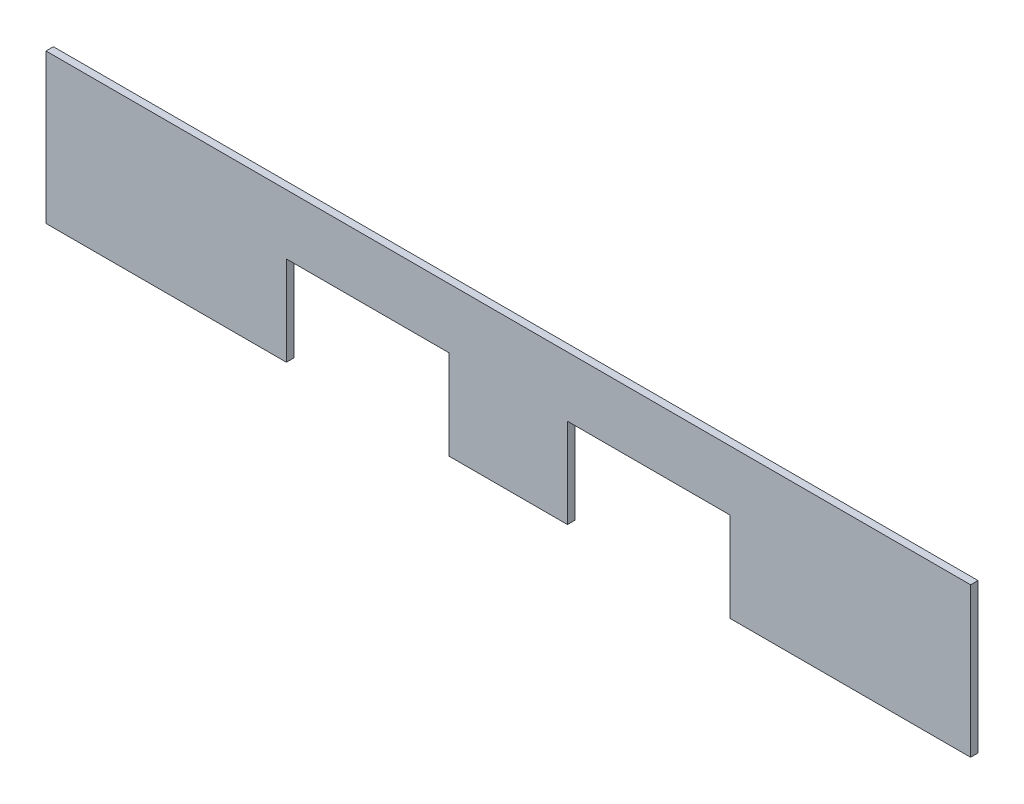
SolidWorks part; units mm, degrees
ref_plane "Front Plane" through (0, 0, 0) normal (0, 0, 1) x (1, 0, 0)
ref_plane "Top Plane" through (0, 0, 0) normal (0, 1, 0) x (1, 0, 0)
ref_plane "Right Plane" through (0, 0, 0) normal (1, 0, 0) x (0, 0, -1)
body saved out of another part "Basisteil-Bodenplatte Berechnung-1"
sketch "Sketch1" plane through (0, 0, 0) normal (0, 0, 1) x (1, 0, 0)
  line L3 (80, 120) -> (80, 0)
  line L4 (80, 0) -> (300, 0)
  line L5 (300, 0) -> (300, 120)
  line L6 (90, 110) -> (90, 10)
  line L7 (290, 110) -> (90, 110)
  line L8 (290, 10) -> (290, 110)
  line L9 (90, 10) -> (290, 10)
  line L10 (90, 110) -> (90, 10) construction
  line L11 (290, 110) -> (90, 110) construction
  line L12 (290, 10) -> (290, 110) construction
  line L13 (90, 10) -> (290, 10) construction
  line L14 (300, 120) -> (80, 120)
  line L15 (-90, 10) -> (-90, 110)
  line L16 (-290, 10) -> (-90, 10)
  line L17 (-290, 110) -> (-290, 10)
  line L18 (-90, 110) -> (-290, 110)
  line L19 (-90, 10) -> (-90, 110) construction
  line L20 (-290, 10) -> (-90, 10) construction
  line L21 (-290, 110) -> (-290, 10) construction
  line L22 (-90, 110) -> (-290, 110) construction
  line L23 (-80, 0) -> (-80, 120)
  line L24 (-80, 120) -> (-300, 120)
  line L25 (-300, 120) -> (-300, 0)
  line L26 (-300, 0) -> (-80, 0)
  dimension "D1" = 0
  dimension "D2" = 0
  dimension "D3" = 10
  dimension "D4" = 10
extrude "Extrude3" cut sketch "Sketch1" along normal through all
sketch "Sketch2" plane through (0, 200, 0) normal (0, 1, 0) x (1, 0, 0)
  line L4 (625, -190) -> (-625, -190)
  line L5 (-625, -190) -> (-625, -200)
  line L6 (-625, -200) -> (625, -200)
  line L7 (625, -200) -> (625, -190)
  line L8 (625, -190) -> (-625, -190)
  line L9 (-625, -190) -> (-625, -200)
  line L10 (-625, -200) -> (625, -200)
  line L11 (625, -200) -> (625, -190)
  dimension "D1" = 0
extrude "Extrude4" add sketch "Sketch2" along normal blind 1
sketch "Sketch3" plane through (0, 0, 0) normal (0, -1, 0) x (1, 0, 0)
  line L4 (300, 200) -> (300, 190)
  line L5 (300, 190) -> (625, 190)
  line L6 (625, 190) -> (625, 200)
  line L7 (625, 200) -> (300, 200)
  line L8 (300, 200) -> (300, 190)
  line L9 (300, 190) -> (625, 190)
  line L10 (625, 190) -> (625, 200)
  line L11 (625, 200) -> (300, 200)
  line L12 (-80, 200) -> (-80, 190)
  line L13 (-80, 190) -> (80, 190)
  line L14 (80, 190) -> (80, 200)
  line L15 (80, 200) -> (-80, 200)
  line L16 (-80, 200) -> (-80, 190)
  line L17 (-80, 190) -> (80, 190)
  line L18 (80, 190) -> (80, 200)
  line L19 (80, 200) -> (-80, 200)
  line L20 (-300, 190) -> (-300, 200)
  line L21 (-300, 200) -> (-625, 200)
  line L22 (-625, 200) -> (-625, 190)
  line L23 (-625, 190) -> (-300, 190)
  line L24 (-300, 190) -> (-300, 200)
  line L25 (-300, 200) -> (-625, 200)
  line L26 (-625, 200) -> (-625, 190)
  line L27 (-625, 190) -> (-300, 190)
  dimension "D1" = 0
  dimension "D2" = 0
  dimension "D3" = 0
extrude "Extrude5" add sketch "Sketch3" along normal blind 1
